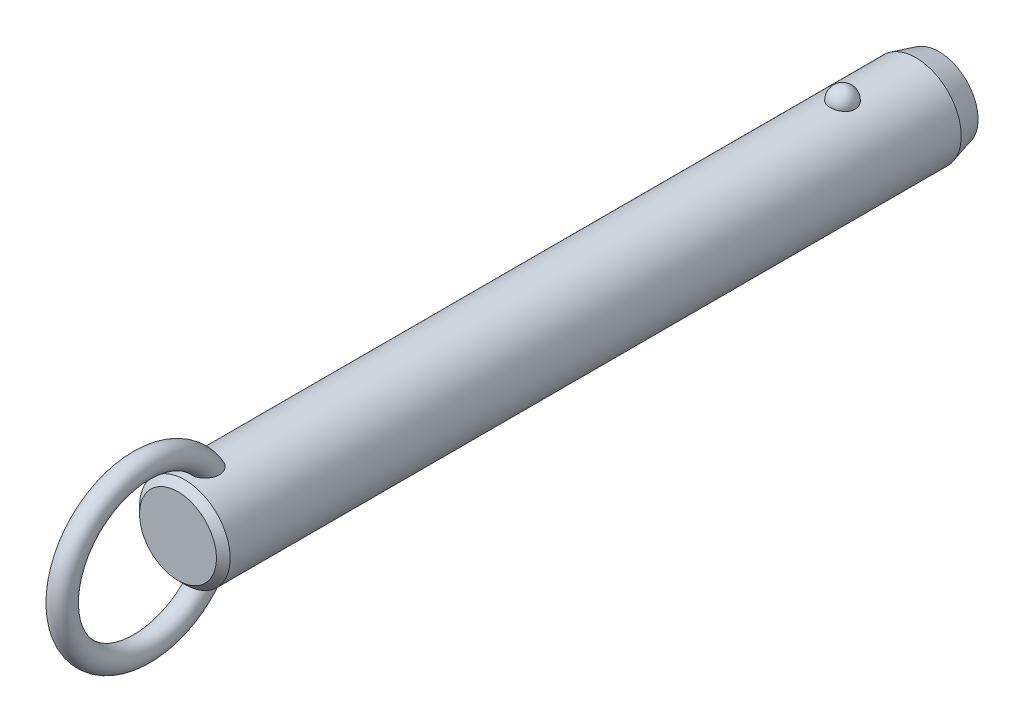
SolidWorks part; units mm, degrees
ref_plane "Front Plane" through (0, 0, 0) normal (0, 0, 1) x (1, 0, 0)
ref_plane "Top Plane" through (0, 0, 0) normal (0, 1, 0) x (1, 0, 0)
ref_plane "Right Plane" through (0, 0, 0) normal (1, 0, 0) x (0, 0, -1)
sketch "Sketch2" plane through (0, 0, 0) normal (0, 0, 1) x (1, 0, 0)
  circle A0 centre (0, 0) radius 7.9
  point P3 (0, 7.9)
  dimension "D1" = 15.8
extrude "Boss-Extrude1" add sketch "Sketch2" along normal blind 104.1
sketch "Sketch3" plane through (0, 0, 0) normal (0, 0, -1) x (-1, 0, 0)
  circle A0 centre (0, 0) radius 7.9
  dimension "D1" = 15.8
extrude "Boss-Extrude2" add sketch "Sketch3" along normal blind 19
chamfer "Chamfer1" distance 4 angle 15 1 edges at (-7.9, 0, -19)
sketch "Sketch12" plane through (0, 0, 0) normal (1, 0, 0) x (0, 0, -1)
  line L0 (-104.1, 7.9) -> (-104.1, -7.9) construction
  point P0 (-104.1, 0)
sketch "Sketch13" plane through (0, 0, 0) normal (1, 0, 0) x (0, 0, -1)
  circle A0 centre (-119.95, 0) radius 15.85
  point P2 (-104.1, 0)
  dimension "D1" = 31.7
sketch "Sketch14" plane through (0, 0, 0) normal (0, 1, 0) x (1, 0, 0)
  circle A0 centre (0, -106.1) radius 2
  point P2 (0, -104.1)
  dimension "D1" = 4
sweep "Sweep1" add profiles "Sketch14" path "Sketch13"
sketch "Sketch15" plane through (0, 0, 104.1) normal (0, 0, 1) x (1, 0, 0)
  circle A0 centre (0, 0) radius 7.9
  dimension "D1" = 15.8
extrude "Boss-Extrude3" add sketch "Sketch15" along normal blind 9.52
chamfer "Chamfer2" distance 1.2 angle 45 1 edges at (7.9, 0, 113.62)
sketch "Sketch18" plane through (0, 0, 0) normal (1, 0, 0) x (0, 0, -1)
  line L0 (15, 7.9) -> (-106.2091, 7.9) construction
  line L1 (2.2, 10.1) -> (2.2, 5.7)
  line L2 (-106.2091, -7.9) -> (15, -7.9) construction
  arc A0 (2.2, 10.1) -> (2.2, 5.7) centre (2.2, 7.9) ccw
  point P4 (0, 7.9)
  dimension "D1" = 18
revolve "Revolve1" add sketch "Sketch18" angle 360 about L1
